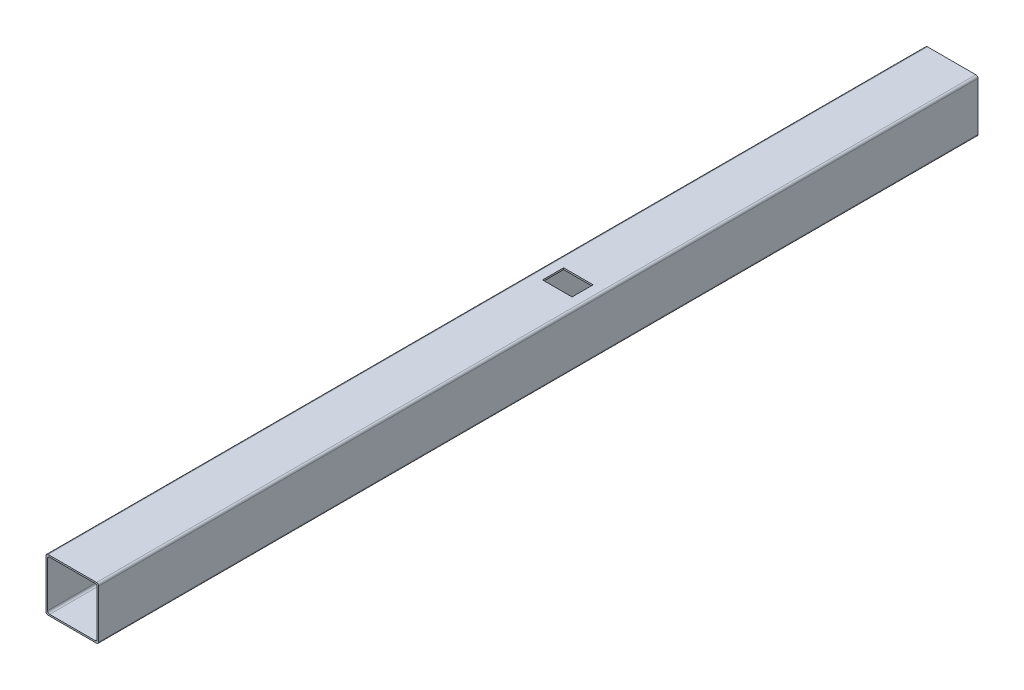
SolidWorks part; units mm, degrees
ref_plane "Plan de face" through (0, 0, 0) normal (0, 0, 1) x (1, 0, 0)
ref_plane "Plan de dessus" through (0, 0, 0) normal (0, 1, 0) x (1, 0, 0)
ref_plane "Plan de droite" through (0, 0, 0) normal (1, 0, 0) x (0, 0, -1)
sketch "Esquisse1" plane through (0, 0, 0) normal (0, 0, 1) x (1, 0, 0)
  line L1 (0, 0) -> (100, 0)
  line L2 (0, 0) -> (0, 100)
  line L3 (0, 100) -> (100, 100)
  line L4 (100, 0) -> (100, 100)
  dimension "D1" = 100
  dimension "D2" = 100
extrude "Extru.-Mince1" add sketch "Esquisse1" along normal blind 1670 thin
fillet "Congé1" radius 4 8 edges at (100, 0, 835) (0, 0, 835) (0, 100, 835) (100, 100, 835) (3, 3, 835) (97, 3, 835) (97, 97, 835) (3, 97, 835)
sketch "Esquisse2" plane through (0, 0, 0) normal (0, -1, 0) x (1, 0, 0)
  line L0 (0, 0) -> (0, 1670) construction
  line L1 (95, 600) -> (5, 600)
  line L2 (95, 600) -> (95, 750)
  line L3 (95, 750) -> (5, 750)
  line L4 (5, 600) -> (5, 750)
  line L5 (100, 1670) -> (100, 0) construction
  line L6 (4, 0) -> (96, 0) construction
  dimension "D1" = 5
  dimension "D2" = 5
  dimension "D3" = 600
  dimension "D4" = 150
extrude "Enlèv. mat.-Extru.1" cut sketch "Esquisse2" against normal up to next contours L3 L4 L1 L2
sketch "Esquisse3" plane through (0, 97, 0) normal (0, -1, 0) x (1, 0, 0)
  line L0 (95, 750) -> (5, 750) construction
  line L1 (22, 749) -> (78, 749)
  line L2 (22, 749) -> (22, 709)
  line L3 (22, 709) -> (78, 709)
  line L4 (78, 749) -> (78, 709)
  line L5 (7, 1670) -> (7, 0) construction
  line L6 (93, 0) -> (93, 1670) construction
  dimension "D1" = 1
  dimension "D2" = 15
  dimension "D3" = 15
  dimension "D4" = 40
extrude "Enlèv. mat.-Extru.2" cut sketch "Esquisse3" against normal blind 10
